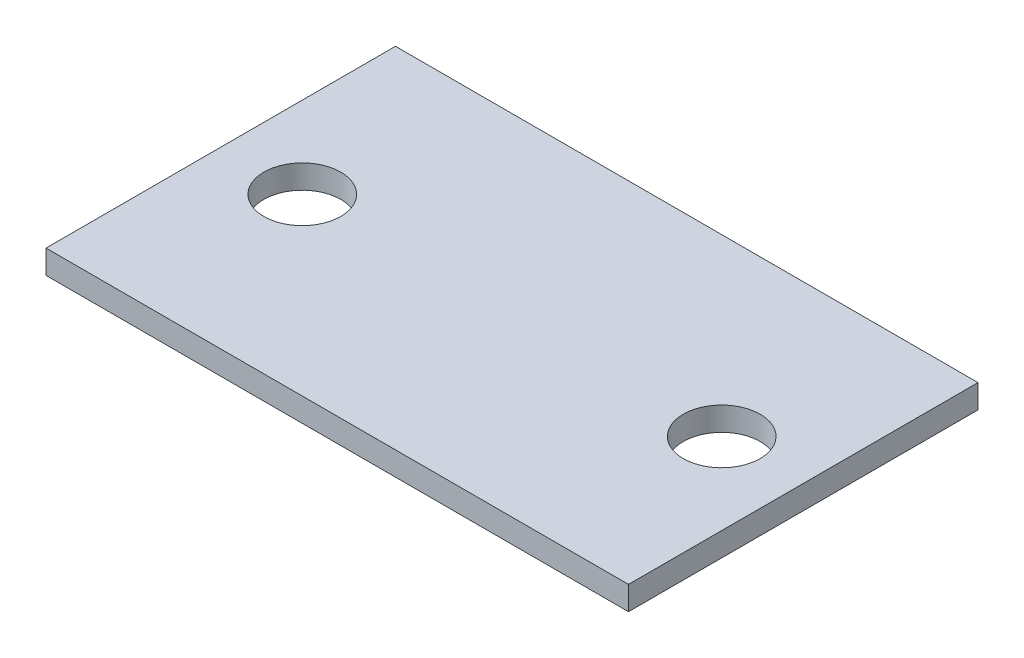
SolidWorks part; units mm, degrees
ref_plane "Front Plane" through (0, 0, 0) normal (0, 0, 1) x (1, 0, 0)
ref_plane "Top Plane" through (0, 0, 0) normal (0, 1, 0) x (1, 0, 0)
ref_plane "Right Plane" through (0, 0, 0) normal (1, 0, 0) x (0, 0, -1)
sketch "Sketch1" plane through (0, 0, 0) normal (0, 1, 0) x (1, 0, 0)
  line L1 (-25, 15) -> (25, 15)
  line L2 (-25, 15) -> (-25, -15)
  line L3 (-25, -15) -> (25, -15)
  line L4 (25, 15) -> (25, -15)
  line L5 (-25, 15) -> (25, -15) construction
  line L6 (-25, -15) -> (25, 15) construction
  point P0 (0, 0)
  dimension "D1" = 50
  dimension "D2" = 30
extrude "Boss-Extrude1" add sketch "Sketch1" along normal blind 2.032
sketch "Sketch2" plane through (0, 2.032, 0) normal (0, 1, 0) x (1, 0, 0)
  line L0 (-25, 0) -> (25, 0) construction
  line L1 (-25, 15) -> (-25, -15) construction
  line L2 (25, -15) -> (25, 15) construction
  line L3 (0, 15) -> (0, -15) construction
  line L4 (25, 15) -> (-25, 15) construction
  line L5 (-25, -15) -> (25, -15) construction
  circle A0 centre (18, 0) radius 3.3
  circle A1 centre (-18, 0) radius 3.3
  dimension "D1" = 6.6
  dimension "D2" = 18
extrude "Cut-Extrude1" cut sketch "Sketch2" against normal through all
